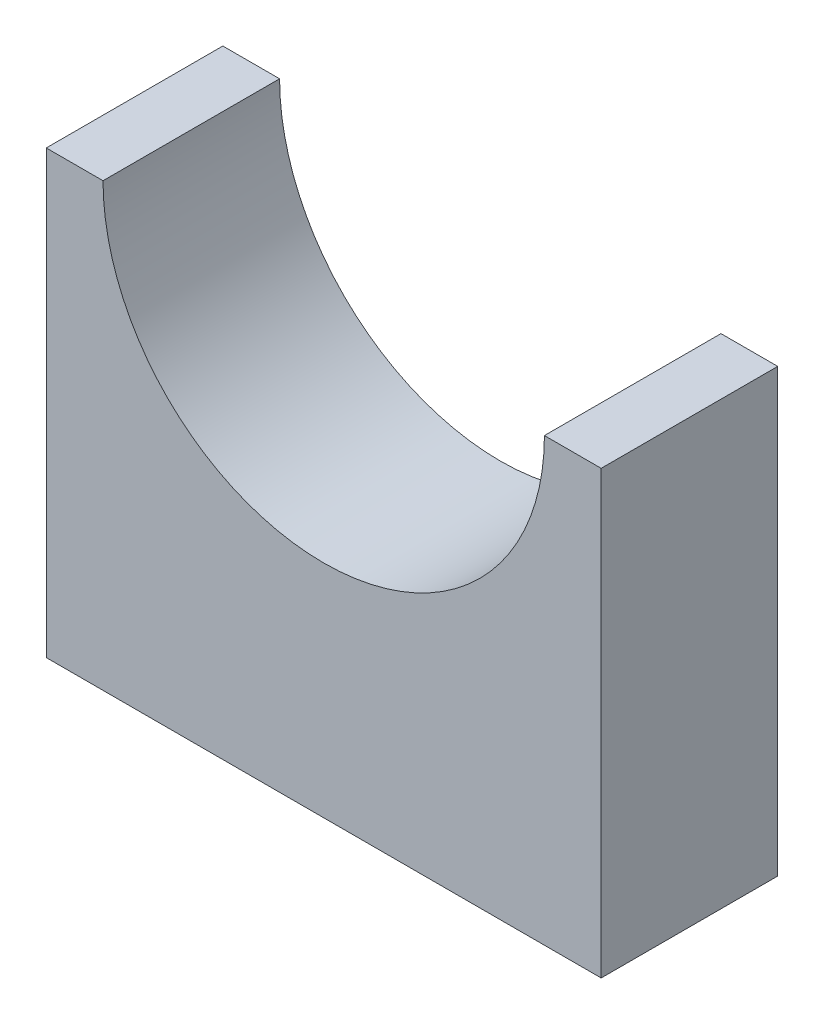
SolidWorks part; units mm, degrees
ref_plane "Front Plane" through (0, 0, 0) normal (0, 0, 1) x (1, 0, 0)
ref_plane "Top Plane" through (0, 0, 0) normal (0, 1, 0) x (1, 0, 0)
ref_plane "Right Plane" through (0, 0, 0) normal (1, 0, 0) x (0, 0, -1)
sketch "Sketch1" plane through (0, 0, 0) normal (0, 0, 1) x (1, 0, 0)
  line L0 (5.1425, 6.2475) -> (6.4283, 6.2475)
  line L1 (-6.1433, 6.2475) -> (-4.8575, 6.2475)
  line L2 (-6.1433, 6.2475) -> (-6.1433, -3.7525)
  line L3 (-6.1433, -3.7525) -> (6.4283, -3.7525)
  line L4 (6.4283, 6.2475) -> (6.4283, -3.7525)
  arc A0 (-4.8575, 6.2475) -> (5.1425, 6.2475) centre (0.1425, 6.2475) ccw
  dimension "D1" = 10
  dimension "D2" = 10
extrude "Boss-Extrude1" add sketch "Sketch1" along normal blind 4
